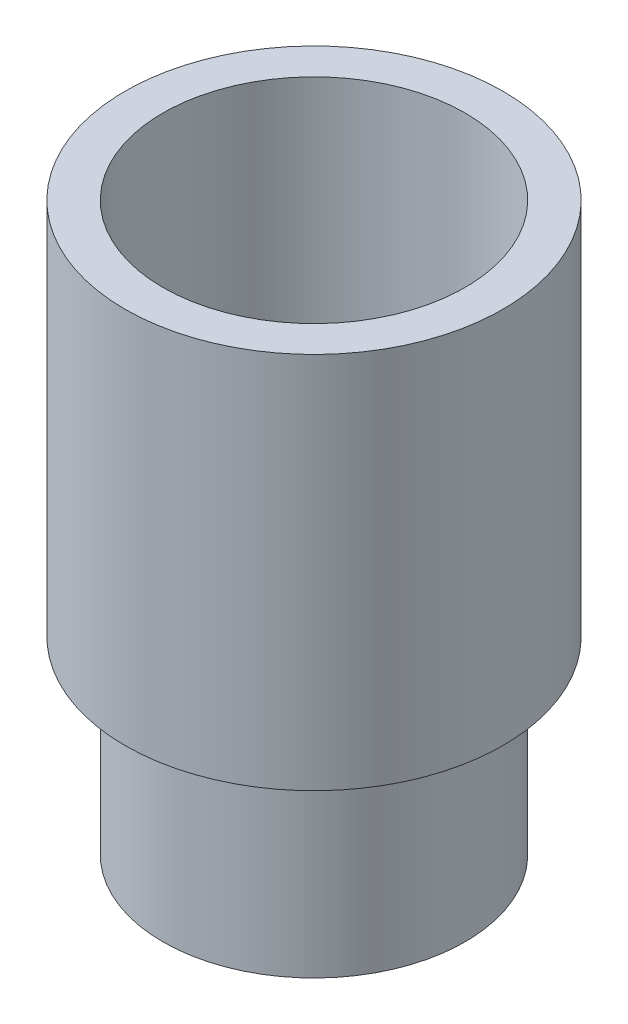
SolidWorks part; units mm, degrees
ref_plane "Front Plane" through (0, 0, 0) normal (0, 0, 1) x (1, 0, 0)
ref_plane "Top Plane" through (0, 0, 0) normal (0, 1, 0) x (1, 0, 0)
ref_plane "Right Plane" through (0, 0, 0) normal (1, 0, 0) x (0, 0, -1)
sketch "Sketch2" plane through (0, 0, 0) normal (0, 1, 0) x (1, 0, 0)
  circle A0 centre (0, 0) radius 4
  circle A1 centre (0, 0) radius 5
  dimension "D1" = 8
  dimension "D2" = 10
extrude "Boss-Extrude1" add sketch "Sketch2" along normal blind 10
sketch "Sketch3" plane through (0, 0, 0) normal (0, -1, 0) x (1, 0, 0)
  circle A0 centre (0, 0) radius 3
  circle A1 centre (0, 0) radius 4
  dimension "D1" = 6
  dimension "D2" = 8
extrude "Boss-Extrude2" add sketch "Sketch3" along normal blind 5 and the other way blind 3 separate body
